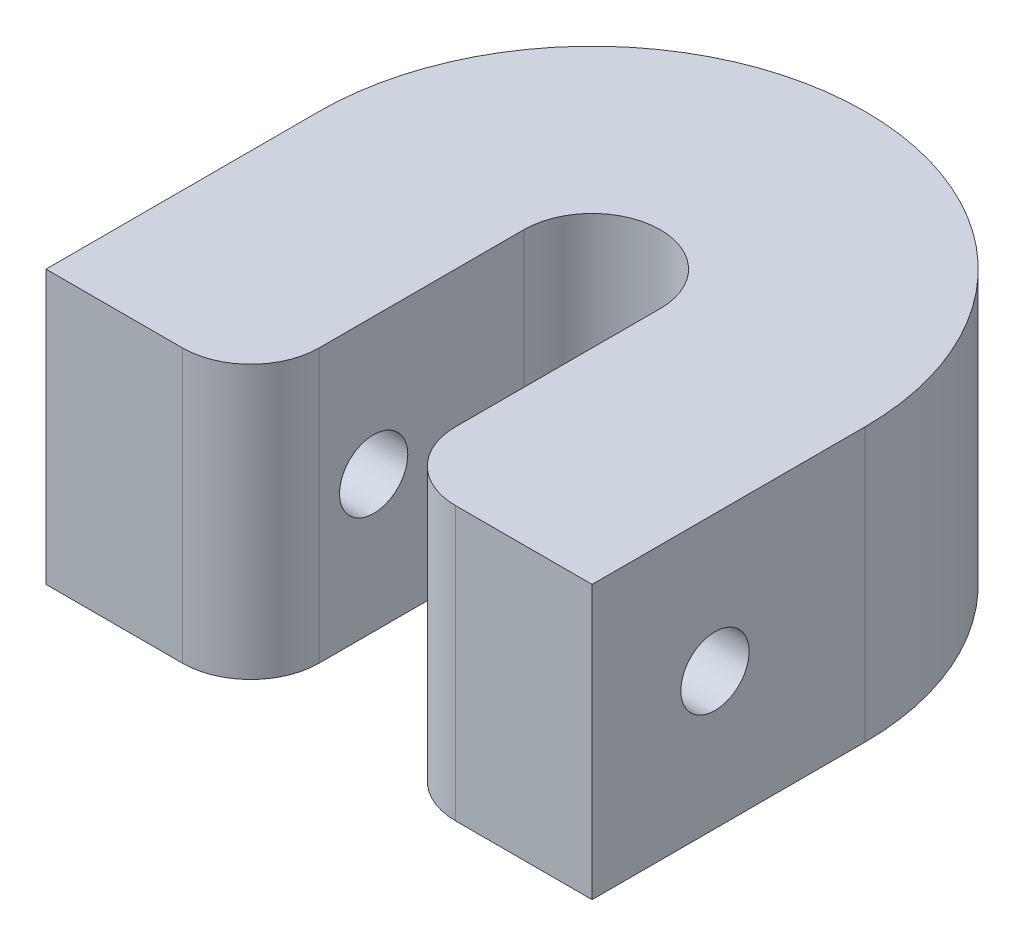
SolidWorks part; units mm, degrees
ref_plane "Front Plane" through (0, 0, 0) normal (0, 0, 1) x (1, 0, 0)
ref_plane "Top Plane" through (0, 0, 0) normal (0, 1, 0) x (1, 0, 0)
ref_plane "Right Plane" through (0, 0, 0) normal (1, 0, 0) x (0, 0, -1)
sketch "Sketch1" plane through (0, 0, 0) normal (0, 1, 0) x (1, 0, 0)
  line L0 (0, 0) -> (0, 230.886) construction
  line L1 (-25.4, 0) -> (-25.4, 230.886)
  line L2 (25.4, 0) -> (25.4, 230.886)
  line L3 (-25.4, 205.486) -> (-6.35, 205.486)
  line L4 (0, 230.886) -> (0, 193.833)
  line L9 (-6.35, 230.886) -> (-6.35, 205.486)
  line L10 (25.4, 205.486) -> (6.35, 205.486)
  line L11 (6.35, 230.886) -> (6.35, 205.486)
  line L13 (-25.4, 215.011) -> (-25.4, 199.136)
  line L15 (25.4, 215.011) -> (25.4, 199.136)
  circle A0 centre (0, 0) radius 6.35
  arc A1 (-25.4, 0) -> (25.4, 0) centre (0, 0) ccw
  arc A2 (25.4, 230.886) -> (-25.4, 230.886) centre (0, 230.886) ccw
  circle A3 centre (0, 230.886) radius 6.35
  point P3 (0, 115.443)
  dimension "D1" = 12.7
  dimension "D2" = 25.4
  dimension "D4" = 12.7
  dimension "D3" = 25.4
extrude "Boss-Extrude1" add sketch "Sketch1" along normal blind 25.4
ref_plane "Plane4" through (0, 0, 0) normal (-1, 0, 0) x (0, 0, 1)
sketch "Sketch4" plane through (25.4, 0, 0) normal (1, 0, 0) x (0, 0, -1)
  line L0 (205.486, 25.4) -> (205.486, 0) construction
  circle A0 centre (216.916, 12.7) radius 3.175
  dimension "D1" = 6.35
  dimension "D2" = 11.43
extrude "Cut-Extrude4" cut sketch "Sketch4" against normal blind 72.898
sketch "Sketch5" plane through (0, 25.4, 0) normal (0, 1, 0) x (1, 0, 0)
  line L0 (-10.325, 230.886) -> (-10.325, 204.8908)
  line L1 (-9.525, 230.886) -> (9.525, 230.886)
  line L2 (-9.525, 230.886) -> (-9.525, 204.8908)
  line L3 (-9.525, 204.8908) -> (9.525, 204.8908)
  line L4 (9.525, 230.886) -> (9.525, 204.8908)
  line L5 (-9.525, 230.886) -> (9.525, 204.8908) construction
  line L6 (-9.525, 204.8908) -> (9.525, 230.886) construction
  line L7 (10.325, 230.886) -> (10.325, 204.8908)
  line L8 (-10.325, 204.8908) -> (10.325, 204.8908)
  circle A1 centre (0, 230.886) radius 9.525
  arc A2 (8.89, 230.886) -> (-8.89, 230.886) centre (0, 230.886) ccw
  arc A3 (8.89, 230.886) -> (-8.89, 230.886) centre (0, 230.886) ccw
  circle A4 centre (0, 230.886) radius 10.325
  point P5 (0, 217.8884)
  dimension "D2" = 19.05
  dimension "D1" = 2.54
  dimension "D3" = 0.8
  dimension "D4" = 0.8
extrude "Cut-Extrude5" cut sketch "Sketch5" against normal blind 32.004
fillet "Fillet1" radius 6.35 2 edges at (-6.35, 12.7, -205.486) (6.35, 12.7, -205.486)
